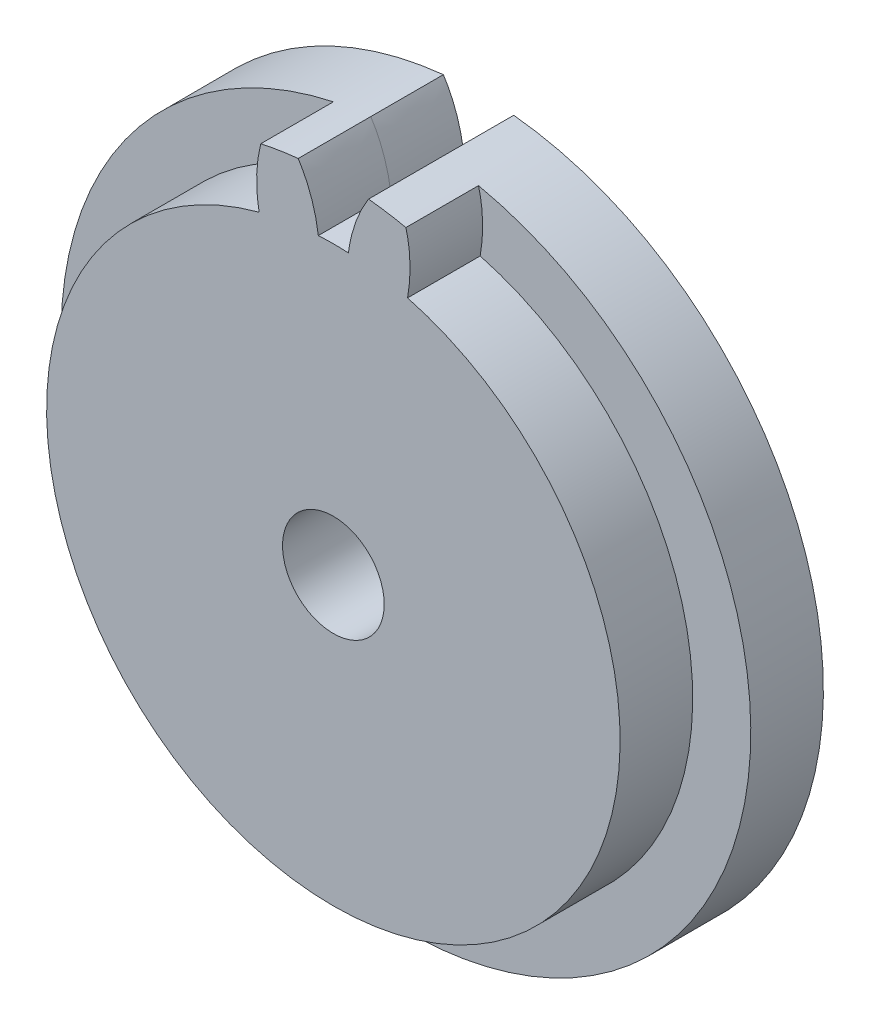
SolidWorks part; units mm, degrees
ref_plane "前基準面" through (0, 0, 0) normal (0, 0, 1) x (1, 0, 0)
ref_plane "上基準面" through (0, 0, 0) normal (0, 1, 0) x (1, 0, 0)
ref_plane "右基準面" through (0, 0, 0) normal (1, 0, 0) x (0, 0, -1)
sketch "草圖1" plane through (0, 0, 0) normal (0, 0, 1) x (1, 0, 0)
  line L0 (0, 0) -> (0, 50) construction
  line L1 (0, 0) -> (7.8217, 49.3844) construction
  line L2 (0, 0) -> (-7.8217, 49.3844) construction
  line L3 (0, 0) -> (2.0673, 39.4459) construction
  line L4 (0, 0) -> (-2.0673, 39.4459) construction
  line L5 (-6.6046, 49.5619) -> (-7.8217, 49.3844)
  line L6 (6.6046, 49.5619) -> (7.8217, 49.3844)
  circle A0 centre (0, 0) radius 7
  circle A1 centre (0, 0) radius 39.5
  circle A2 centre (0, 0) radius 45 construction
  circle A3 centre (0, 0) radius 50 construction
  spline S0 degree 2 poles (-2.0673, 39.4459) (-2.884, 45.4275) (-6.6046, 49.5619) knots 0 0 0 1 1 1
  spline S1 degree 2 poles (2.0673, 39.4459) (2.884, 45.4275) (6.6046, 49.5619) knots 0 0 0 1 1 1
  dimension "D1" = 100
  dimension "D2" = 90
  dimension "D3" = 79
  dimension "D4" = 14
  dimension "D5" = 9
  dimension "D7" = 6
  dimension "D8" = 1.23
sketch "草圖2" plane through (0, 0, 0) normal (0, 0, 1) x (1, 0, 0)
  line L0 (0, 63) -> (0, 50) construction
  line L1 (0, 63) -> (-6.8883, 46.3702) construction
  line L2 (0, 63) -> (6.8883, 46.3702) construction
  line L3 (0, 63) -> (-3.4455, 50.9842) construction
  line L4 (0, 63) -> (3.4455, 50.9842) construction
  line L5 (-1.625, 40) -> (1.625, 40)
  line L7 (0, 0) -> (0, 50) construction
  circle A0 centre (0, 63) radius 5
  circle A1 centre (0, 0) radius 7 construction
  circle A2 centre (0, 63) radius 12.5
  circle A3 centre (0, 63) radius 18 construction
  circle A4 centre (0, 0) radius 45 construction
  spline S0 degree 2 poles (-1.625, 40) (-4.1616, 45.4635) (-3.4455, 50.9842) knots 0 0 0 1 1 1
  spline S1 degree 2 poles (1.625, 40) (4.1616, 45.4635) (3.4455, 50.9842) knots 0 0 0 1 1 1
  point P17 (0, 40)
  dimension "D1" = 63
  dimension "D2" = 10
  dimension "D3" = 25
  dimension "D4" = 45
  dimension "D5" = 22.5
  dimension "D6" = 32
  dimension "D7" = 3.25
  dimension "D8" = 23
sketch "草圖3" plane through (0, 0, 0) normal (0, 0, 1) x (1, 0, 0)
  circle A0 centre (0, 0) radius 39.5 construction
  arc A1 (2.0673, 39.4459) -> (-2.0673, 39.4459) centre (0, 0) ccw
  arc A2 (14.1555, 36.8764) -> (10.2234, 38.1541) centre (0, 0) ccw
  arc A3 (24.8582, 30.6973) -> (21.5132, 33.1275) centre (0, 0) ccw
  arc A4 (33.1275, 21.5132) -> (30.6973, 24.8582) centre (0, 0) ccw
  arc A5 (38.1541, 10.2234) -> (36.8764, 14.1555) centre (0, 0) ccw
  arc A6 (39.4459, -2.0673) -> (39.4459, 2.0673) centre (0, 0) ccw
  arc A7 (36.8764, -14.1555) -> (38.1541, -10.2234) centre (0, 0) ccw
  arc A8 (30.6973, -24.8582) -> (33.1275, -21.5132) centre (0, 0) ccw
  arc A9 (21.5132, -33.1275) -> (24.8582, -30.6973) centre (0, 0) ccw
  arc A10 (10.2234, -38.1541) -> (14.1555, -36.8764) centre (0, 0) ccw
  arc A11 (-2.0673, -39.4459) -> (2.0673, -39.4459) centre (0, 0) ccw
  arc A12 (-14.1555, -36.8764) -> (-10.2234, -38.1541) centre (0, 0) ccw
  arc A13 (-24.8582, -30.6973) -> (-21.5132, -33.1275) centre (0, 0) ccw
  arc A14 (-33.1275, -21.5132) -> (-30.6973, -24.8582) centre (0, 0) ccw
  arc A15 (-38.1541, -10.2234) -> (-36.8764, -14.1555) centre (0, 0) ccw
  arc A16 (-39.4459, 2.0673) -> (-39.4459, -2.0673) centre (0, 0) ccw
  arc A17 (-36.8764, 14.1555) -> (-38.1541, 10.2234) centre (0, 0) ccw
  arc A18 (-30.6973, 24.8582) -> (-33.1275, 21.5132) centre (0, 0) ccw
  arc A19 (-21.5132, 33.1275) -> (-24.8582, 30.6973) centre (0, 0) ccw
  arc A20 (-10.2234, 38.1541) -> (-14.1555, 36.8764) centre (0, 0) ccw
  circle A21 centre (0, 0) radius 50 construction
  arc A22 (-21.5968, 45.0952) -> (-23.7885, 43.9785) centre (0, 0) ccw
  arc A23 (-6.6046, 49.5619) -> (-9.0341, 49.1771) centre (0, 0) ccw
  arc A24 (9.0341, 49.1771) -> (6.6046, 49.5619) centre (0, 0) ccw
  arc A25 (23.7885, 43.9785) -> (21.5968, 45.0952) centre (0, 0) ccw
  arc A26 (36.2143, 34.475) -> (34.475, 36.2143) centre (0, 0) ccw
  arc A27 (45.0952, 21.5968) -> (43.9785, 23.7885) centre (0, 0) ccw
  arc A28 (49.5619, 6.6046) -> (49.1771, 9.0341) centre (0, 0) ccw
  arc A29 (49.1771, -9.0341) -> (49.5619, -6.6046) centre (0, 0) ccw
  arc A30 (43.9785, -23.7885) -> (45.0952, -21.5968) centre (0, 0) ccw
  arc A31 (34.475, -36.2143) -> (36.2143, -34.475) centre (0, 0) ccw
  arc A32 (21.5968, -45.0952) -> (23.7885, -43.9785) centre (0, 0) ccw
  arc A33 (6.6046, -49.5619) -> (9.0341, -49.1771) centre (0, 0) ccw
  arc A34 (-9.0341, -49.1771) -> (-6.6046, -49.5619) centre (0, 0) ccw
  arc A35 (-23.7885, -43.9785) -> (-21.5968, -45.0952) centre (0, 0) ccw
  arc A36 (-36.2143, -34.475) -> (-34.475, -36.2143) centre (0, 0) ccw
  arc A37 (-45.0952, -21.5968) -> (-43.9785, -23.7885) centre (0, 0) ccw
  arc A38 (-49.5619, -6.6046) -> (-49.1771, -9.0341) centre (0, 0) ccw
  arc A39 (-49.1771, 9.0341) -> (-49.5619, 6.6046) centre (0, 0) ccw
  arc A40 (-43.9785, 23.7885) -> (-45.0952, 21.5968) centre (0, 0) ccw
  arc A41 (-34.475, 36.2143) -> (-36.2143, 34.475) centre (0, 0) ccw
  circle A42 centre (0, 0) radius 7
  parabola Q0 construction
  parabola Q1 construction
  parabola Q2
  parabola Q3
  parabola Q4
  parabola Q5
  parabola Q6
  parabola Q7
  parabola Q8
  parabola Q9
  parabola Q10
  parabola Q11
  parabola Q12
  parabola Q13
  parabola Q14
  parabola Q15
  parabola Q16
  parabola Q17
  parabola Q18
  parabola Q19
  parabola Q20
  parabola Q21
  parabola Q22
  parabola Q23
  parabola Q24
  parabola Q25
  parabola Q26
  parabola Q27
  parabola Q28
  parabola Q29
  parabola Q30
  parabola Q31
  parabola Q32
  parabola Q33
  parabola Q34
  parabola Q35
  parabola Q36
  parabola Q37
  parabola Q38
  parabola Q39
  parabola Q40
  parabola Q41
  point P169 (0, 0)
  dimension "D2" = 14
  dimension "D1" = 20
extrude "填料-伸長1" add sketch "草圖3" along normal blind 10
sketch "草圖4" plane through (0, 0, 0) normal (0, 0, 1) x (1, 0, 0)
  arc A0 (2.0673, 39.4459) -> (-2.0673, 39.4459) centre (0, 0) ccw construction
  arc A1 (2.0673, 39.4459) -> (-2.0673, 39.4459) centre (0, 0) ccw
  arc A2 (-6.6046, 49.5619) -> (6.6046, 49.5619) centre (0, 0) ccw
  parabola Q0 construction
  parabola Q1 construction
  parabola Q2
  parabola Q3
extrude "填料-伸長2" add sketch "草圖4" against normal blind 10
extrude "除料-伸長1" cut sketch "草圖1" against normal blind 10 contours A0
sketch "草圖6" plane through (0, 0, 10) normal (0, 0, 1) x (1, 0, 0)
  arc A0 (-14.1555, 36.8764) -> (-21.5132, 33.1275) centre (0, 0) ccw
  arc A1 (-24.8582, 30.6973) -> (-30.6973, 24.8582) centre (0, 0) ccw
  arc A2 (-33.1275, 21.5132) -> (-36.8764, 14.1555) centre (0, 0) ccw
  arc A3 (-38.1541, 10.2234) -> (-39.4459, 2.0673) centre (0, 0) ccw
  arc A4 (-39.4459, -2.0673) -> (-38.1541, -10.2234) centre (0, 0) ccw
  arc A5 (-36.8764, -14.1555) -> (-33.1275, -21.5132) centre (0, 0) ccw
  arc A6 (-30.6973, -24.8582) -> (-24.8582, -30.6973) centre (0, 0) ccw
  arc A7 (-21.5132, -33.1275) -> (-14.1555, -36.8764) centre (0, 0) ccw
  arc A8 (-10.2234, -38.1541) -> (-2.0673, -39.4459) centre (0, 0) ccw
  arc A9 (2.0673, -39.4459) -> (10.2234, -38.1541) centre (0, 0) ccw
  arc A10 (14.1555, -36.8764) -> (21.5132, -33.1275) centre (0, 0) ccw
  arc A11 (24.8582, -30.6973) -> (30.6973, -24.8582) centre (0, 0) ccw
  arc A12 (33.1275, -21.5132) -> (36.8764, -14.1555) centre (0, 0) ccw
  arc A13 (38.1541, -10.2234) -> (39.4459, -2.0673) centre (0, 0) ccw
  arc A14 (39.4459, 2.0673) -> (38.1541, 10.2234) centre (0, 0) ccw
  arc A15 (36.8764, 14.1555) -> (33.1275, 21.5132) centre (0, 0) ccw
  arc A16 (30.6973, 24.8582) -> (24.8582, 30.6973) centre (0, 0) ccw
  arc A17 (21.5132, 33.1275) -> (14.1555, 36.8764) centre (0, 0) ccw
  arc A40 (2.0673, 39.4459) -> (-2.0673, 39.4459) centre (0, 0) ccw
  arc A41 (-6.6046, 49.5619) -> (-9.0341, 49.1771) centre (0, 0) ccw
  arc A42 (-10.2234, 38.1541) -> (-14.1555, 36.8764) centre (0, 0) ccw
  arc A43 (-21.5968, 45.0952) -> (-23.7885, 43.9785) centre (0, 0) ccw
  arc A44 (-21.5132, 33.1275) -> (-24.8582, 30.6973) centre (0, 0) ccw
  arc A45 (-34.475, 36.2143) -> (-36.2143, 34.475) centre (0, 0) ccw
  arc A46 (-30.6973, 24.8582) -> (-33.1275, 21.5132) centre (0, 0) ccw
  arc A47 (-43.9785, 23.7885) -> (-45.0952, 21.5968) centre (0, 0) ccw
  arc A48 (-36.8764, 14.1555) -> (-38.1541, 10.2234) centre (0, 0) ccw
  arc A49 (-49.1771, 9.0341) -> (-49.5619, 6.6046) centre (0, 0) ccw
  arc A50 (-39.4459, 2.0673) -> (-39.4459, -2.0673) centre (0, 0) ccw
  arc A51 (-49.5619, -6.6046) -> (-49.1771, -9.0341) centre (0, 0) ccw
  arc A52 (-38.1541, -10.2234) -> (-36.8764, -14.1555) centre (0, 0) ccw
  arc A53 (-45.0952, -21.5968) -> (-43.9785, -23.7885) centre (0, 0) ccw
  arc A54 (-33.1275, -21.5132) -> (-30.6973, -24.8582) centre (0, 0) ccw
  arc A55 (-36.2143, -34.475) -> (-34.475, -36.2143) centre (0, 0) ccw
  arc A56 (-24.8582, -30.6973) -> (-21.5132, -33.1275) centre (0, 0) ccw
  arc A57 (-23.7885, -43.9785) -> (-21.5968, -45.0952) centre (0, 0) ccw
  arc A58 (-14.1555, -36.8764) -> (-10.2234, -38.1541) centre (0, 0) ccw
  arc A59 (-9.0341, -49.1771) -> (-6.6046, -49.5619) centre (0, 0) ccw
  arc A60 (-2.0673, -39.4459) -> (2.0673, -39.4459) centre (0, 0) ccw
  arc A61 (6.6046, -49.5619) -> (9.0341, -49.1771) centre (0, 0) ccw
  arc A62 (10.2234, -38.1541) -> (14.1555, -36.8764) centre (0, 0) ccw
  arc A63 (21.5968, -45.0952) -> (23.7885, -43.9785) centre (0, 0) ccw
  arc A64 (21.5132, -33.1275) -> (24.8582, -30.6973) centre (0, 0) ccw
  arc A65 (34.475, -36.2143) -> (36.2143, -34.475) centre (0, 0) ccw
  arc A66 (30.6973, -24.8582) -> (33.1275, -21.5132) centre (0, 0) ccw
  arc A67 (43.9785, -23.7885) -> (45.0952, -21.5968) centre (0, 0) ccw
  arc A68 (36.8764, -14.1555) -> (38.1541, -10.2234) centre (0, 0) ccw
  arc A69 (49.1771, -9.0341) -> (49.5619, -6.6046) centre (0, 0) ccw
  arc A70 (39.4459, -2.0673) -> (39.4459, 2.0673) centre (0, 0) ccw
  arc A71 (49.5619, 6.6046) -> (49.1771, 9.0341) centre (0, 0) ccw
  arc A72 (38.1541, 10.2234) -> (36.8764, 14.1555) centre (0, 0) ccw
  arc A73 (45.0952, 21.5968) -> (43.9785, 23.7885) centre (0, 0) ccw
  arc A74 (33.1275, 21.5132) -> (30.6973, 24.8582) centre (0, 0) ccw
  arc A75 (36.2143, 34.475) -> (34.475, 36.2143) centre (0, 0) ccw
  arc A76 (24.8582, 30.6973) -> (21.5132, 33.1275) centre (0, 0) ccw
  arc A77 (23.7885, 43.9785) -> (21.5968, 45.0952) centre (0, 0) ccw
  arc A78 (14.1555, 36.8764) -> (10.2234, 38.1541) centre (0, 0) ccw
  arc A79 (9.0341, 49.1771) -> (6.6046, 49.5619) centre (0, 0) ccw
  arc A83 (-21.5968, 45.0952) -> (-23.7885, 43.9785) centre (0, 0) ccw
  arc A85 (-34.475, 36.2143) -> (-36.2143, 34.475) centre (0, 0) ccw
  arc A87 (-43.9785, 23.7885) -> (-45.0952, 21.5968) centre (0, 0) ccw
  arc A89 (-49.1771, 9.0341) -> (-49.5619, 6.6046) centre (0, 0) ccw
  arc A91 (-49.5619, -6.6046) -> (-49.1771, -9.0341) centre (0, 0) ccw
  arc A93 (-45.0952, -21.5968) -> (-43.9785, -23.7885) centre (0, 0) ccw
  arc A95 (-36.2143, -34.475) -> (-34.475, -36.2143) centre (0, 0) ccw
  arc A97 (-23.7885, -43.9785) -> (-21.5968, -45.0952) centre (0, 0) ccw
  arc A99 (-9.0341, -49.1771) -> (-6.6046, -49.5619) centre (0, 0) ccw
  arc A101 (6.6046, -49.5619) -> (9.0341, -49.1771) centre (0, 0) ccw
  arc A103 (21.5968, -45.0952) -> (23.7885, -43.9785) centre (0, 0) ccw
  arc A105 (34.475, -36.2143) -> (36.2143, -34.475) centre (0, 0) ccw
  arc A107 (43.9785, -23.7885) -> (45.0952, -21.5968) centre (0, 0) ccw
  arc A109 (49.1771, -9.0341) -> (49.5619, -6.6046) centre (0, 0) ccw
  arc A111 (49.5619, 6.6046) -> (49.1771, 9.0341) centre (0, 0) ccw
  arc A113 (45.0952, 21.5968) -> (43.9785, 23.7885) centre (0, 0) ccw
  arc A115 (36.2143, 34.475) -> (34.475, 36.2143) centre (0, 0) ccw
  arc A117 (23.7885, 43.9785) -> (21.5968, 45.0952) centre (0, 0) ccw
  arc A119 (9.0341, 49.1771) -> (6.6046, 49.5619) centre (0, 0) ccw
  parabola Q40
  parabola Q41
  parabola Q42
  parabola Q43
  parabola Q44
  parabola Q45
  parabola Q46
  parabola Q47
  parabola Q48
  parabola Q49
  parabola Q50
  parabola Q51
  parabola Q52
  parabola Q53
  parabola Q54
  parabola Q55
  parabola Q56
  parabola Q57
  parabola Q58
  parabola Q59
  parabola Q60
  parabola Q61
  parabola Q62
  parabola Q63
  parabola Q64
  parabola Q65
  parabola Q66
  parabola Q67
  parabola Q68
  parabola Q69
  parabola Q70
  parabola Q71
  parabola Q72
  parabola Q73
  parabola Q74
  parabola Q75
  parabola Q76
  parabola Q77
  parabola Q78
  parabola Q79
  parabola Q82
  parabola Q83
  parabola Q84
  parabola Q85
  parabola Q86
  parabola Q87
  parabola Q88
  parabola Q89
  parabola Q90
  parabola Q91
  parabola Q92
  parabola Q93
  parabola Q94
  parabola Q95
  parabola Q96
  parabola Q97
  parabola Q98
  parabola Q99
  parabola Q100
  parabola Q101
  parabola Q102
  parabola Q103
  parabola Q104
  parabola Q105
  parabola Q106
  parabola Q107
  parabola Q108
  parabola Q109
  parabola Q110
  parabola Q111
  parabola Q112
  parabola Q113
  parabola Q114
  parabola Q115
  parabola Q116
  parabola Q117
  parabola Q118
  parabola Q119
  dimension "D1" = 0
extrude "除料-伸長2" cut sketch "草圖6" against normal blind 10 contours A117 Q118 A17 Q117 | A115 Q116 A16 Q115 | A113 Q114 A15 Q113 | A111 Q112 A14 Q111 | A109 Q110 A13 Q109 | A107 Q108 A12 Q107 | A105 Q106 A11 Q105 | A103 Q104 A10 Q103 | A101 Q102 A9 Q101 | A99 Q100 A8 Q99 | A97 Q98 A7 Q97 | A95 Q96 A6 Q95 | A93 Q94 A5 Q93 | A91 Q92 A4 Q91 | A89 Q90 A3 Q89 | A87 Q88 A2 Q87 | A85 Q86 A1 Q85 | A83 Q84 A0 Q83
sketch "草圖7" plane through (0, 0, 0) normal (0, 0, 1) x (1, 0, 0)
  circle A0 centre (0, 0) radius 47.5
  circle A1 centre (0, 0) radius 57.5
  dimension "D1" = 95
  dimension "D2" = 10
extrude "除料-伸長3" cut sketch "草圖7" against normal through all both and the other way through all
